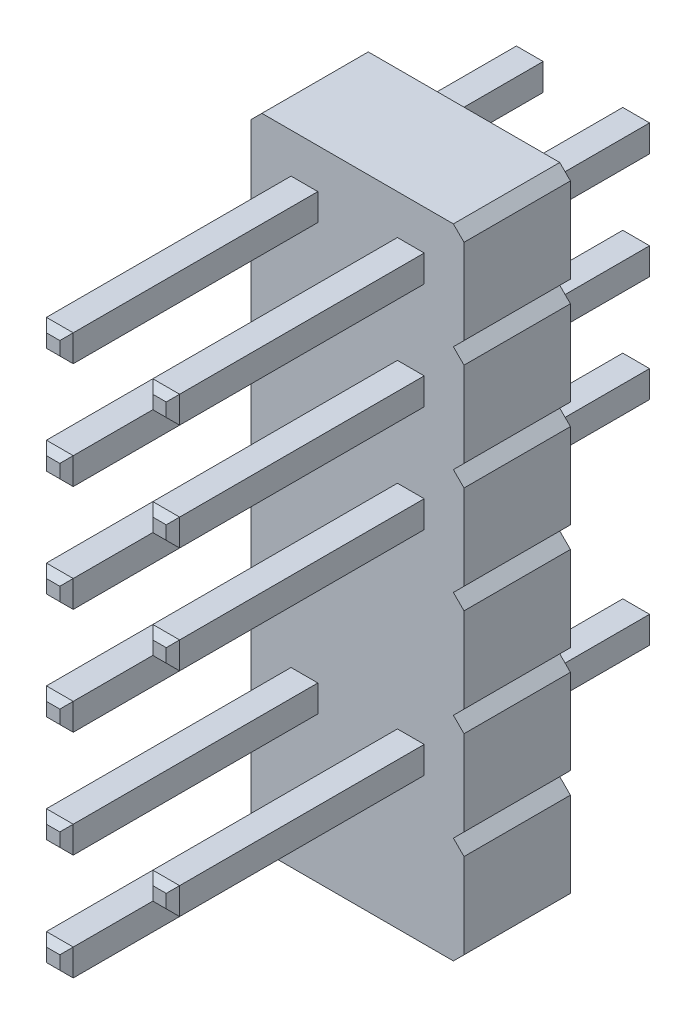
SolidWorks part; units mm, degrees
ref_plane "Płaszczyzna przednia" through (0, 0, 0) normal (0, 0, 1) x (1, 0, 0)
ref_plane "Płaszczyzna górna" through (0, 0, 0) normal (0, 1, 0) x (1, 0, 0)
ref_plane "Płaszczyzna prawa" through (0, 0, 0) normal (1, 0, 0) x (0, 0, -1)
imported_body "PinHeader_2x06_P2.54mm_Vertical.step"
sketch "Szkic1" plane through (0, 0, 2.54) normal (0, 0, 1) x (1, 0, 0)
  line L1 (1.3559, -6.6587) -> (3.3207, -6.6587)
  line L2 (1.3559, -6.6587) -> (1.3559, -8.7154)
  line L3 (1.3559, -8.7154) -> (3.3207, -8.7154)
  line L4 (3.3207, -6.6587) -> (3.3207, -8.7154)
  line L5 (1.1781, -11.8338) -> (3.3207, -11.8338)
  line L6 (1.1781, -11.8338) -> (1.1781, -13.7833)
  line L7 (1.1781, -13.7833) -> (3.3207, -13.7833)
  line L8 (3.3207, -11.8338) -> (3.3207, -13.7833)
extrude "Wytnij-wyciągnięcie1" cut sketch "Szkic1" along normal blind 10
sketch "Szkic2" plane through (0, 0, 0) normal (0, 0, -1) x (-1, 0, 0)
  line L0 (-3.556, -6.35) -> (-3.81, -6.096) construction
  line L1 (-3.683, -6.223) -> (-1.174, -6.223)
  line L2 (-3.683, -6.223) -> (-3.683, -9.2908)
  line L3 (-3.683, -9.2908) -> (-1.174, -9.2908)
  line L4 (-1.174, -6.223) -> (-1.174, -9.2908)
  line L6 (-2.9653, -11.4699) -> (-1.6047, -11.4699)
  line L7 (-2.9653, -11.4699) -> (-2.9653, -13.6072)
  line L8 (-2.9653, -13.6072) -> (-1.6047, -13.6072)
  line L9 (-1.6047, -11.4699) -> (-1.6047, -13.6072)
extrude "Wytnij-wyciągnięcie2" cut sketch "Szkic2" along normal blind 10
